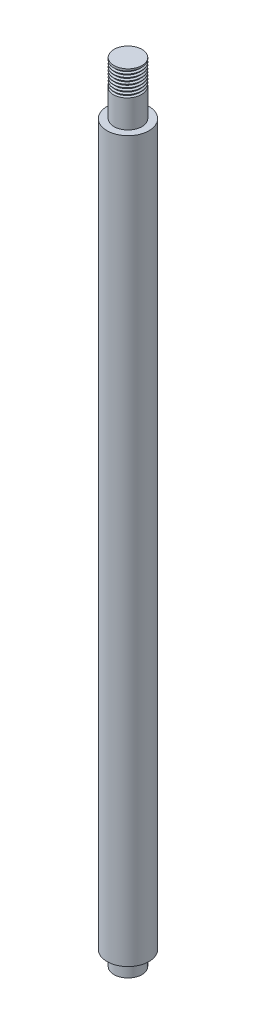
SolidWorks part; units mm, degrees
ref_plane "Front Plane" through (0, 0, 0) normal (0, 0, 1) x (1, 0, 0)
ref_plane "Top Plane" through (0, 0, 0) normal (0, 1, 0) x (1, 0, 0)
ref_plane "Right Plane" through (0, 0, 0) normal (1, 0, 0) x (0, 0, -1)
sketch "Sketch1" plane through (0, 0, 0) normal (0, 1, 0) x (1, 0, 0)
  circle A0 centre (0, 0) radius 2.25
  dimension "D1" = 4.5
extrude "Boss-Extrude1" add sketch "Sketch1" along normal blind 77.1
sketch "Sketch2" plane through (0, 0, 0) normal (0, -1, 0) x (1, 0, 0)
  circle A0 centre (0, 0) radius 1.5
  dimension "D1" = 3
extrude "Boss-Extrude2" add sketch "Sketch2" along normal blind 1.5875
sketch "Sketch3" plane through (0, 77.1, 0) normal (0, 1, 0) x (1, 0, 0)
  circle A0 centre (0, 0) radius 1.5
  dimension "D1" = 3
extrude "Boss-Extrude3" add sketch "Sketch3" along normal blind 5.675
thread "Thread1" pitch 0.3175 start angle 0, offset 0, length 2.5, pitch 0.3175, diameter 3
ref_plane "Plane1" through (-1.5, 82.775, 0) normal (0, 0, 1) x (-1, 0, 0)
sketch "Thread Profile1" plane through (-1.5, 82.775, 0) normal (0, 0, 1) x (-1, 0, 0)
  line L0 (0, 0) -> (0, 0.3175) construction
  line L11 (0, 0) -> (0, 0.2778)
  line L12 (0, 0.2778) -> (-0.1719, 0.1786)
  line L13 (-0.1719, 0.1786) -> (-0.1719, 0.0992)
  line L15 (-0.1719, 0.0992) -> (0, 0)
  line L17 (-0.1719, 0.1389) -> (0, 0.1389) construction
  point P2 (0, 0)
  dimension "Pitch" = 0.3175
  dimension "Profile_Angle" = 60
  dimension "Profile_Land" = 0.0794
  dimension "Profile_Height" = 0.1719
